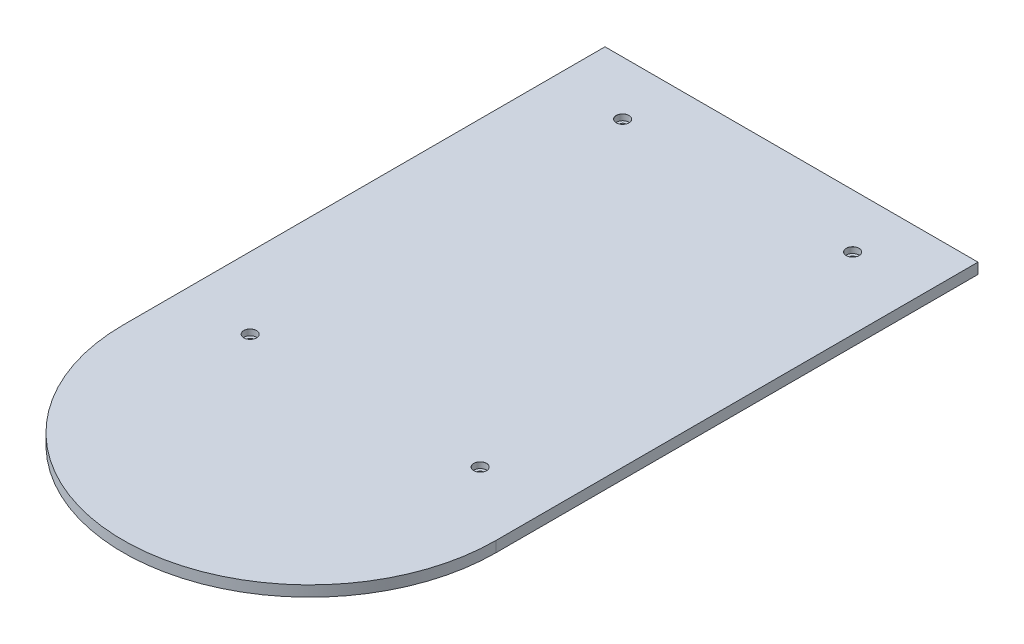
SolidWorks part; units mm, degrees
ref_plane "Front Plane" through (0, 0, 0) normal (0, 0, 1) x (1, 0, 0)
ref_plane "Top Plane" through (0, 0, 0) normal (0, 1, 0) x (1, 0, 0)
ref_plane "Right Plane" through (0, 0, 0) normal (1, 0, 0) x (0, 0, -1)
sketch "Sketch1" plane through (0, 0, 0) normal (0, 1, 0) x (1, 0, 0)
  line L0 (0, 123.0312) -> (0, -123.0312) construction
  line L2 (-95.25, -123.0312) -> (-95.25, 123.0312)
  line L3 (-95.25, 123.0312) -> (95.25, 123.0312)
  line L4 (95.25, -123.0312) -> (95.25, 123.0312)
  line L5 (-95.25, 0) -> (95.25, 0) construction
  line L6 (-95.25, -123.0312) -> (95.25, -123.0312) construction
  arc A0 (95.25, -123.0312) -> (-95.25, -123.0312) centre (0, -123.0312) cw
  point P0 (0, 0)
  point P11 (0, -123.0312)
  dimension "D1" = 246.0625
  dimension "D2" = 190.5
extrude "Boss-Extrude1" add sketch "Sketch1" along normal blind 5.461
sketch "Sketch4" plane through (0, 5.461, 0) normal (0, 1, 0) x (1, 0, 0)
  line L0 (0, 123.0312) -> (0, 0) construction
  line L1 (95.25, 123.0312) -> (-95.25, 123.0312) construction
  line L2 (0, 0) -> (-95.25, 0) construction
  line L3 (-95.25, 123.0312) -> (-95.25, -123.0312) construction
  line L4 (-95.25, -123.0313) -> (0, -123.0312) construction
  line L5 (-58.7375, 95.5358) -> (-58.7375, 73.3107) construction
  line L6 (-58.7375, 73.3107) -> (0, 73.3107) construction
  circle A0 centre (-46.0375, 76.4858) radius 3.937 construction
  circle A1 centre (-58.7375, 95.5358) radius 1.905
  circle A3 centre (-46.0375, -75.6476) radius 2.54 construction
  circle A4 centre (-58.7375, -94.6976) radius 1.905
  circle A5 centre (58.7375, -94.6976) radius 1.905
  circle A6 centre (58.7375, 95.5358) radius 1.905
  dimension "D3" = 19.05
  dimension "D5" = 47.3837
  dimension "D7" = 19.05
  dimension "D9" = 3.81
  dimension "D10" = 3.81
  dimension "D1" = 46.0375
  dimension "D2" = 46.5455
  dimension "D4" = 12.7
  dimension "D6" = 46.0375
  dimension "D8" = 12.7
hole_wizard "CBORE for M3 SHCS2" positions "3DSketch2" profile "Sketch9" counterbore size "M3" standard "ANSI Metric"
sketch3d "3DSketch2"
  point P0 (-58.7375, 5.461, -95.5358)
  point P3 (58.7375, 5.461, -95.5358)
  point P6 (58.7375, 5.461, 94.6976)
  point P9 (-58.7375, 5.461, 94.6976)
sketch "Sketch9" plane through (-58.7375, 5.461, -95.5358) normal (1, 0, 0) x (0, 0, 1)
  line L0 (0, 0) -> (0, 5.461)
  line L1 (0, 5.461) -> (1.7, 5.461)
  line L3 (1.7, 5.461) -> (1.7, 3)
  line L4 (3.25, 3) -> (1.7, 3)
  line L5 (3.25, 3) -> (3.25, 0.025)
  line L6 (3.25, 0.025) -> (3.275, 0)
  line L7 (3.275, 0) -> (0, 0)
  line L8 (-3.25, 0.025) -> (-3.275, 0) construction
  line L11 (0, -6.35) -> (0, 107.95) construction
  dimension "Thru Hole Dia." = 3.4
  dimension "Thru Hole Depth" = 5.461
  dimension "C'Bore Dia." = 6.5
  dimension "C'Bore Depth" = 3
  dimension "Near C'Sink Dia." = 6.55
  dimension "Near C'Sink Angle" = 90
